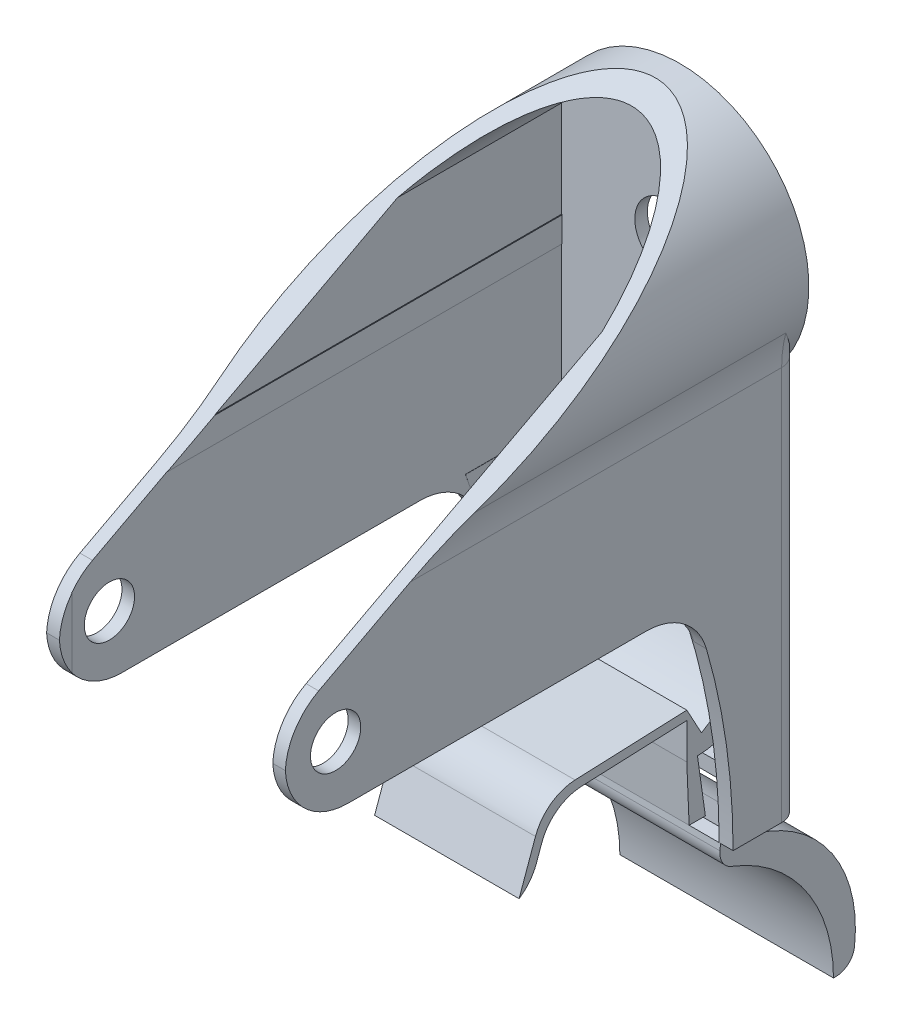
SolidWorks part; units mm, degrees
ref_plane "Спереди" through (0, 0, 0) normal (0, 0, 1) x (1, 0, 0)
ref_plane "Сверху" through (0, 0, 0) normal (0, 1, 0) x (1, 0, 0)
ref_plane "Справа" through (0, 0, 0) normal (1, 0, 0) x (0, 0, -1)
imported_body "Импортированный1"
imported_body "Импортированный2"
sketch "Эскиз2" plane through (0, 0, 0.0077) normal (0, 0, -1) x (-1, 0, 0)
  line L1 (11.0707, 10.8823) -> (11.0707, -16.9452) construction
  line L2 (-5.0909, -24.9791) -> (26.9091, -24.9791) construction
  circle A0 centre (11.0707, 8.3809) radius 5.2
  dimension "D1" = 33.36
  dimension "D3" = 10.4
extrude "Вырез-Вытянуть3" cut sketch "Эскиз2" against normal blind 10
